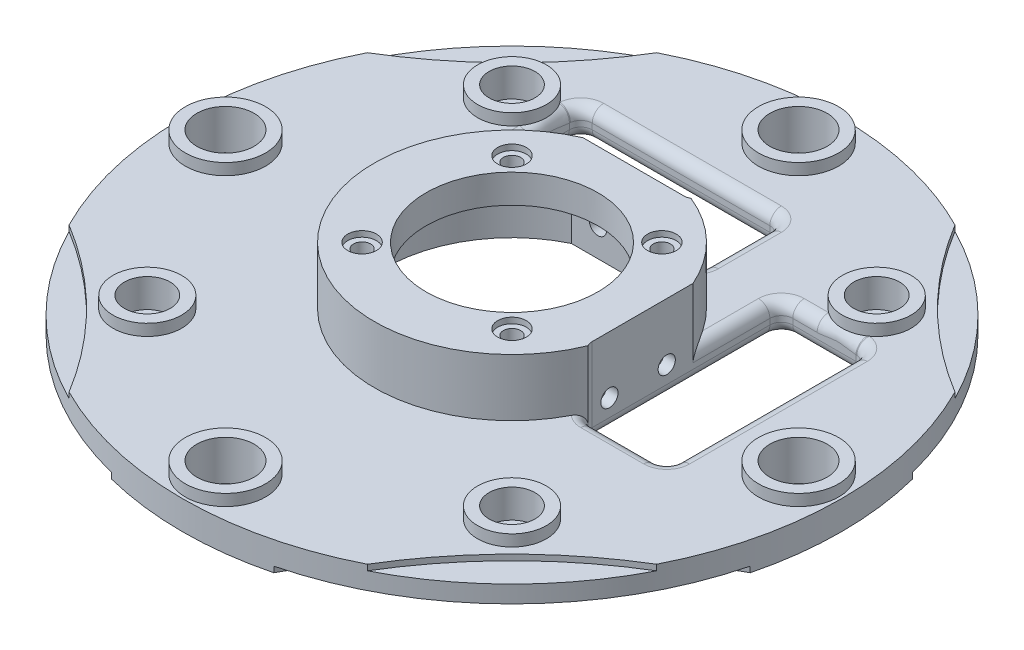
SolidWorks part; units mm, degrees
ref_plane "Front Plane" through (0, 0, 0) normal (0, 0, 1) x (1, 0, 0)
ref_plane "Top Plane" through (0, 0, 0) normal (0, 1, 0) x (1, 0, 0)
ref_plane "Right Plane" through (0, 0, 0) normal (1, 0, 0) x (0, 0, -1)
sketch "Sketch1" plane through (0, 0, 0) normal (0, 1, 0) x (1, 0, 0)
  circle A0 centre (0, 0) radius 57.5
  circle A1 centre (0, 0) radius 50 construction
  circle A2 centre (0, 50) radius 5
  circle A3 centre (50, 0) radius 5
  circle A4 centre (0, -50) radius 5
  circle A5 centre (-50, 0) radius 5
  point P15 (0, 0)
  dimension "D1" = 100
  dimension "D2" = 115
  dimension "D3" = 10
  dimension "D4" = 4
extrude "Boss-Extrude1" add sketch "Sketch1" along normal blind 5
sketch "Sketch2" plane through (0, 5, 0) normal (0, 1, 0) x (1, 0, 0)
  circle A0 centre (0, 0) radius 24
  dimension "D1" = 48
extrude "Boss-Extrude2" add sketch "Sketch2" along normal blind 10
sketch "Sketch3" plane through (0, 0, 0) normal (0, -1, 0) x (-1, 0, 0)
  line L1 (0, -22.2) -> (-20, -22.2)
  line L2 (0, -22.2) -> (0, 22.2)
  line L3 (0, 22.2) -> (-20, 22.2)
  line L4 (-20, -22.2) -> (-20, 22.2)
  line L5 (22.2, 0) -> (-22.2, 0)
  line L6 (22.2, 0) -> (22.2, 20)
  line L7 (22.2, 20) -> (-22.2, 20)
  line L8 (-22.2, 0) -> (-22.2, 20)
  circle A0 centre (0, 0) radius 22.2
  dimension "D1" = 44.4
  dimension "D2" = 20
  dimension "D3" = 20
  dimension "D4" = 44.4
  dimension "D5" = 44.4
extrude "Cut-Extrude1" cut sketch "Sketch3" against normal blind 10 contours L4 A0 L2 L5 | L2 A0 L5 | L5 A0 L7 L2 | L7 A0 L4 L5 L2
sketch "Sketch4" plane through (0, 15, 0) normal (0, 1, 0) x (1, 0, 0)
  line L0 (0, 0) -> (13.0815, 13.0815) construction
  circle A0 centre (0, 0) radius 18.5 construction
  circle A2 centre (13.0815, 13.0815) radius 1.5
  circle A3 centre (13.0815, -13.0815) radius 1.5
  circle A4 centre (-13.0815, -13.0815) radius 1.5
  circle A5 centre (-13.0815, 13.0815) radius 1.5
  point P14 (0, 0)
  dimension "D1" = 37
  dimension "D2" = 3
  dimension "D3" = 4
extrude "Cut-Extrude2" cut sketch "Sketch4" against normal blind 10
sketch "Sketch5" plane through (0, 15, 0) normal (0, 1, 0) x (1, 0, 0)
  line L1 (-24, 0) -> (22, 0)
  line L2 (-24, 0) -> (-24, 22)
  line L3 (-24, 22) -> (22, 22)
  line L4 (22, 0) -> (22, 22)
  line L5 (0, -24) -> (22, -24)
  line L6 (0, -24) -> (0, 22)
  line L7 (0, 22) -> (22, 22)
  line L8 (22, -24) -> (22, 22)
  circle A0 centre (0, 0) radius 24 construction
  circle A1 centre (0, 0) radius 24 construction
  circle A2 centre (0, 0) radius 24
  dimension "D1" = 22
  dimension "D2" = 22
extrude "Cut-Extrude3" cut sketch "Sketch5" against normal blind 10 contours L3 M8 | L8 L4 M8
sketch "Sketch6" plane through (0, 15, 0) normal (0, 1, 0) x (1, 0, 0)
  circle A0 centre (0, 0) radius 15
  dimension "D1" = 30
extrude "Cut-Extrude4" cut sketch "Sketch6" against normal blind 10
sketch "Sketch7" plane through (0, 0, -22) normal (0, 0, -1) x (-1, 0, 0)
  line L0 (0, 5) -> (0, 15) construction
  line L1 (9.5917, 5) -> (-9.5917, 5) construction
  line L2 (9.5917, 15) -> (-9.5917, 15) construction
  circle A0 centre (5, 5) radius 3.5
  circle A1 centre (-5, 5) radius 3.5
  dimension "D1" = 7
  dimension "D2" = 7
  dimension "D3" = 5
  dimension "D4" = 5
  dimension "D5" = 10
  dimension "D6" = 10
extrude "Cut-Extrude5" cut sketch "Sketch7" along normal blind 10
sketch "Sketch8" plane through (22, 0, 0) normal (1, 0, 0) x (0, 0, -1)
  line L0 (0, 5) -> (0, 15) construction
  line L1 (-9.5917, 5) -> (9.5917, 5) construction
  line L2 (-9.5917, 15) -> (9.5917, 15) construction
  line L3 (57.5, 5) -> (-57.5, 5) construction
  circle A0 centre (5, 5) radius 3.5
  circle A1 centre (-5, 5) radius 3.5
  dimension "D3" = 7
  dimension "D4" = 7
  dimension "D1" = 5
  dimension "D2" = 5
extrude "Cut-Extrude6" cut sketch "Sketch8" along normal blind 10
sketch "Sketch9" plane through (22, 0, 0) normal (1, 0, 0) x (0, 0, -1)
  circle A0 centre (-5, 5) radius 1.5
  circle A1 centre (5, 5) radius 1.5
  dimension "D1" = 3
  dimension "D2" = 3
extrude "Cut-Extrude7" cut sketch "Sketch9" against normal blind 10
sketch "Sketch10" plane through (0, 0, -22) normal (0, 0, -1) x (-1, 0, 0)
  circle A0 centre (5, 5) radius 1.5
  circle A1 centre (-5, 5) radius 1.5
  dimension "D1" = 3
  dimension "D2" = 3
extrude "Cut-Extrude8" cut sketch "Sketch10" against normal blind 10
sketch "Sketch11" plane through (0, 5, 0) normal (0, 1, 0) x (1, 0, 0)
  line L0 (0, 50) -> (0, 0) construction
  line L1 (0, 0) -> (-31.8198, 31.8198) construction
  circle A2 centre (0, 0) radius 45 construction
  circle A5 centre (-31.8198, 31.8198) radius 6
  circle A6 centre (31.8198, 31.8198) radius 6
  circle A7 centre (31.8198, -31.8198) radius 6
  circle A8 centre (-31.8198, -31.8198) radius 6
  point P16 (0, 0)
  dimension "D1" = 90
  dimension "D2" = 12
  dimension "D3" = 4
extrude "Boss-Extrude3" add sketch "Sketch11" along normal blind 2
sketch "Sketch12" plane through (0, 7, 0) normal (0, 1, 0) x (1, 0, 0)
  circle A0 centre (-31.8198, 31.8198) radius 4
  circle A1 centre (31.8198, 31.8198) radius 4
  circle A2 centre (31.8198, -31.8198) radius 4
  circle A3 centre (-31.8198, -31.8198) radius 4
  point P12 (0, 0)
  dimension "D1" = 8
  dimension "D2" = 4
extrude "Cut-Extrude9" cut sketch "Sketch12" against normal blind 5
sketch "Sketch13" plane through (0, 5, 0) normal (0, 1, 0) x (1, 0, 0)
  circle A0 centre (0, 50) radius 7
  circle A1 centre (0, 50) radius 5
  circle A2 centre (0, 50) radius 5 construction
  circle A3 centre (50, 0) radius 5
  circle A4 centre (50, 0) radius 7
  circle A5 centre (0, -50) radius 5
  circle A6 centre (0, -50) radius 7
  circle A7 centre (-50, 0) radius 5
  circle A8 centre (-50, 0) radius 7
  point P18 (0, 0)
  dimension "D1" = 2
  dimension "D2" = 4
extrude "Boss-Extrude4" add sketch "Sketch13" along normal blind 2
sketch "Sketch15" plane through (0, 15, 0) normal (0, 1, 0) x (1, 0, 0)
  circle A0 centre (-13.0815, -13.0815) radius 2.5
  circle A2 centre (-13.0815, 13.0815) radius 2.5
  circle A3 centre (13.0815, 13.0815) radius 2.5
  circle A4 centre (13.0815, -13.0815) radius 2.5
  point P12 (0, 0)
  dimension "D1" = 5
  dimension "D2" = 4
extrude "Cut-Extrude10" cut sketch "Sketch15" against normal blind 1
sketch "Sketch16" plane through (0, 5, 0) normal (0, 1, 0) x (1, 0, 0)
  line L1 (10, 22) -> (-25, 22)
  line L2 (10, 22) -> (10, 37)
  line L3 (10, 37) -> (-25, 37)
  line L4 (-25, 22) -> (-25, 37)
  line L5 (22, -10) -> (37, -10)
  line L6 (22, -10) -> (22, 25)
  line L7 (22, 25) -> (37, 25)
  line L8 (37, -10) -> (37, 25)
  dimension "D1" = 22
  dimension "D2" = 15
  dimension "D3" = 10
  dimension "D4" = 25
  dimension "D5" = 22
  dimension "D6" = 15
  dimension "D7" = 10
  dimension "D8" = 25
extrude "Cut-Extrude11" cut sketch "Sketch16" against normal blind 11
fillet "Fillet1" radius 2 8 edges at (-25, 2.5, -37) (-25, 2.5, -22) (10, 2.5, -37) (10, 2.5, -22) (37, 2.5, -25) (22, 2.5, -25) (37, 2.5, 10) (22, 2.5, 10)
fillet "Fillet2" radius 2 32 edges at (36.4142, 0, -24.4142) (37, 0, -7.5) (36.4142, 0, 9.4142) (29.5, 0, 10) (22.5858, 0, 9.4142) (22, 0, -7.5) (22.5858, 0, -24.4142) (-7.5, 0, -22) (-24.4142, 0, -22.5858) (-25, 0, -29.5) (-24.4142, 0, -36.4142) (-7.5, 0, -37) (9.4142, 0, -36.4142) (10, 0, -29.5) (9.7263, 5, -22.9901) (-16.2958, 5, -22) (-24.4142, 5, -22.5858) (-25, 5, -29.5) (-24.4142, 5, -36.4142) (-7.5, 5, -37) (9.4142, 5, -36.4142) (22.9901, 5, 9.7263) (29.5, 5, 10) (36.4142, 5, 9.4142) (22, 5, -16.2958) (22.5858, 5, -24.4142) (29.5, 5, -25) (36.4142, 5, -24.4142) (29.5, 0, -25) (9.4142, 0, -22.5858) (10, 5, -29.5) (37, 5, -7.5)
sketch "Sketch17" plane through (0, 15, 0) normal (0, 1, 0) x (1, 0, 0)
  line L0 (3.97, 3.97) -> (35.7898, 35.7898) construction
  circle A0 centre (90.1561, 90.1561) radius 75
  circle A1 centre (90.1561, -90.1561) radius 75
  circle A2 centre (-90.1561, -90.1561) radius 75
  circle A3 centre (-90.1561, 90.1561) radius 75
  point P16 (0, 0)
  dimension "D1" = 150
  dimension "D2" = 127.5
  dimension "D3" = 4
extrude "Cut-Extrude12" cut sketch "Sketch17" against normal blind 11
sketch "Sketch18" plane through (0, 0, 0) normal (0, -1, 0) x (-1, 0, 0)
  line L0 (0, 0) -> (-56.3135, -56.3135) construction
  circle A0 centre (-102.5305, -102.5305) radius 100
  circle A1 centre (-102.5305, 102.5305) radius 100
  circle A2 centre (102.5305, 102.5305) radius 100
  circle A3 centre (102.5305, -102.5305) radius 100
  point P15 (0, 0)
  dimension "D1" = 200
  dimension "D2" = 145
  dimension "D3" = 4
extrude "Cut-Extrude13" cut sketch "Sketch18" against normal blind 1
